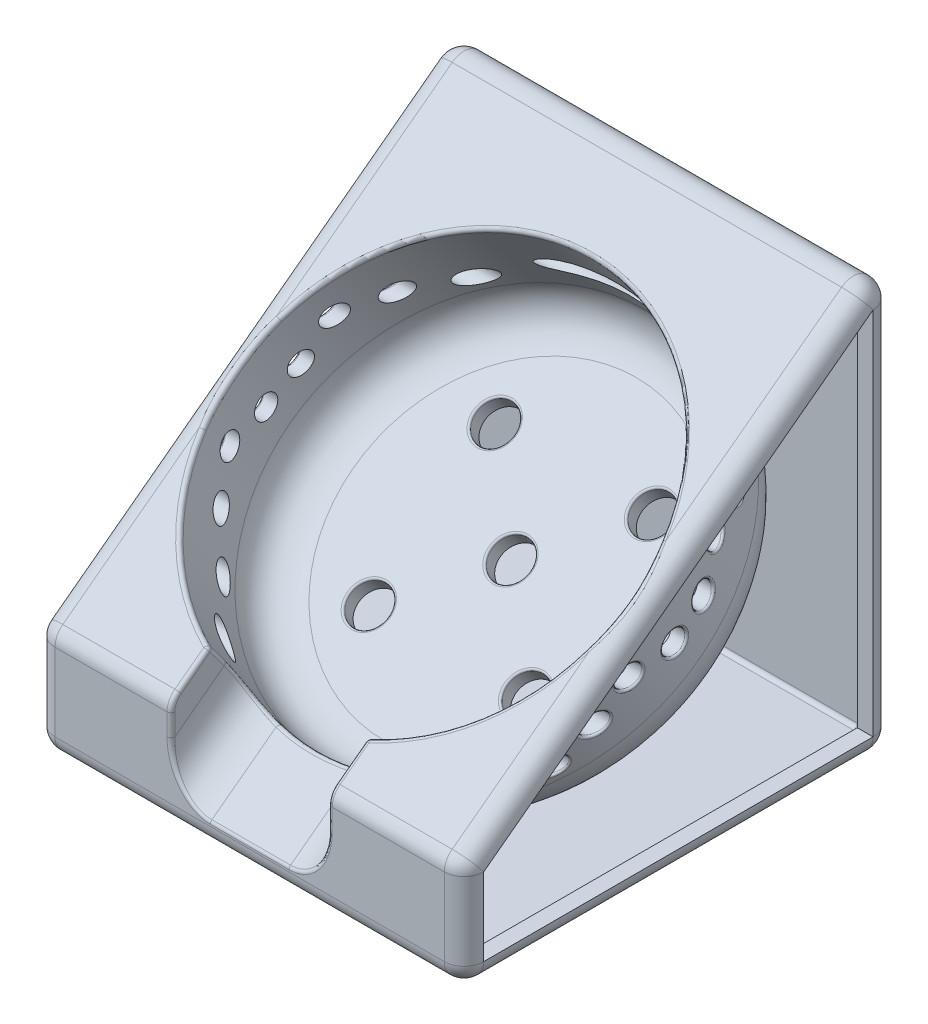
SolidWorks part; units mm, degrees
ref_plane "Front Plane" through (0, 0, 0) normal (0, 0, 1) x (1, 0, 0)
ref_plane "Top Plane" through (0, 0, 0) normal (0, 1, 0) x (1, 0, 0)
ref_plane "Right Plane" through (0, 0, 0) normal (1, 0, 0) x (0, 0, -1)
sketch "Sketch1" plane through (0, 0, 0) normal (0, 1, 0) x (1, 0, 0)
  line L1 (-54.5, -54.5) -> (54.5, -54.5)
  line L2 (-54.5, -54.5) -> (-54.5, 54.5)
  line L3 (-54.5, 54.5) -> (54.5, 54.5)
  line L4 (54.5, -54.5) -> (54.5, 54.5)
  line L5 (-54.5, -54.5) -> (54.5, 54.5) construction
  line L6 (-54.5, 54.5) -> (54.5, -54.5) construction
  point P0 (0, 0)
  dimension "D1" = 109
  dimension "D2" = 109
extrude "Boss-Extrude1" add sketch "Sketch1" along normal blind 109
sketch "Sketch2" plane through (54.5, 0, 0) normal (1, 0, 0) x (0, 0, -1)
  line L0 (-54.5, 0) -> (-54.5, 27.25)
  line L1 (-54.5, 109) -> (-54.5, 0) construction
  line L2 (-54.5, 27.25) -> (54.5, 109)
extrude "Cut-Extrude1" cut sketch "Sketch2" against normal blind 109 and the other way through all
sketch "Sketch3" plane through (0, 43.6, 32.7) normal (0, 0.8, 0.6) x (1, 0, 0)
  line L0 (-54.5, 109) -> (54.5, -27.25) construction
  line L1 (54.5, 109) -> (-54.5, -27.25) construction
  line L2 (0, 40.875) -> (0, 30.875) construction
  circle A1 centre (0, 30.875) radius 50
  dimension "D1" = 100
extrude "Cut-Extrude2" cut sketch "Sketch3" against normal blind 33
fillet "Fillet1" radius 10 1 edges at (0, 5.725, 28.2)
fillet "Fillet3" radius 5 12 edges at (0, 109, -54.5) (-54.5, 54.5, -54.5) (0, 0, -54.5) (54.5, 54.5, -54.5) (54.5, 0, 0) (54.5, 13.625, 54.5) (54.5, 68.125, 0) (-54.5, 0, 0) (0, 0, 54.5) (-54.5, 13.625, 54.5) (0, 27.25, 54.5) (-54.5, 68.125, 0)
fillet "Fillet4" radius 1 4 edges at (49.9106, 63.905, 5.5986) (0, 32.125, 48) (0, 92.125, -32) (-49.9106, 60.318, 10.3812)
sketch "Sketch5" plane through (0, 43.6, 32.7) normal (0, 0.8, 0.6) x (1, 0, 0)
  line L0 (0, 0) -> (0, -24.75) construction
  line L1 (-49.5, -24.75) -> (49.5, -24.75) construction
  line L3 (20, -39.75) -> (-20, -39.75)
  line L4 (20, -39.75) -> (20, -9.75)
  line L5 (20, -9.75) -> (-20, -9.75)
  line L6 (-20, -39.75) -> (-20, -9.75)
  line L7 (20, -39.75) -> (-20, -9.75) construction
  line L8 (20, -9.75) -> (-20, -39.75) construction
  dimension "D1" = 40
  dimension "D2" = 30
extrude "Cut-Extrude3" cut sketch "Sketch5" against normal blind 17
fillet "Fillet7" radius 10 2 edges at (20, 13.5898, 44.3803) (-20, 13.5898, 44.3803)
shell "Shell5" thickness 4
sketch "Sketch7" plane through (0, 4, 0) normal (0, 1, 0) x (1, 0, 0)
  line L0 (0, 0) -> (0, -25) construction
  line L2 (-5, -30) -> (5, -30)
  line L3 (-5, -30) -> (-5, -20)
  line L4 (-5, -20) -> (5, -20)
  line L5 (5, -30) -> (5, -20)
  line L6 (-5, -30) -> (5, -20) construction
  line L7 (-5, -20) -> (5, -30) construction
  dimension "D1" = 10
  dimension "D2" = 10
extrude "Boss-Extrude2" add sketch "Sketch7" along normal blind 5
fillet "Fillet8" radius 5 4 edges at (-5, 5.227, 30) (5, 5.6177, 20) (-5, 5.6177, 20) (5, 5.227, 30)
fillet "Fillet10" radius 1 15 edges at (17.9248, 10.8762, 54.5) (20, 21.625, 54.5) (20, 26.9861, 53.9721) (20, 31.3631, 49.0159) (20, 34.2076, 44.8969) (20, 31.4295, 42.2606) (16.3398, 21.9853, 36.9637) (0, 18.525, 37.8) (-18.0688, 23.8266, 37.5525) (-20, 31.4295, 42.2606) (-20, 34.2018, 44.7233) (-20, 31.3631, 49.0159) (-20, 26.9861, 53.9721) (-20, 21.625, 54.5) (-17.9248, 10.8762, 54.5)
sketch "Sketch8" plane through (0, 0, 0) normal (1, 0, 0) x (0, 0, -1)
  line L0 (34.0313, 71.1485) -> (37.0313, 67.1485) construction
  line L1 (-32.3687, 26.3485) -> (-26.9687, 19.1485) construction
  line L2 (-37.4, 11.325) -> (49, 76.125) construction
  line L3 (39.632, 80.3477) -> (45.0313, 73.1485) construction
  line L4 (39.632, 80.3477) -> (34.0313, 71.1485) construction
  line L5 (34.0313, 71.1485) -> (23.6318, 68.3479) construction
  line L6 (23.6318, 68.3479) -> (13.2313, 65.5485) construction
  line L7 (13.2313, 65.5485) -> (7.6317, 56.3481) construction
  line L8 (7.6317, 56.3481) -> (-0.3684, 50.3481) construction
  line L9 (-0.3684, 50.3481) -> (-10.7687, 47.5485) construction
  line L10 (-10.7687, 47.5485) -> (-16.3685, 38.3483) construction
  line L11 (-16.3685, 38.3483) -> (-21.9687, 29.1485) construction
  line L12 (-21.9687, 29.1485) -> (-32.3687, 26.3485) construction
  line L13 (23.6318, 68.3479) -> (29.0313, 61.1485) construction
  line L14 (13.2313, 65.5485) -> (21.0313, 55.1485) construction
  line L15 (7.6317, 56.3481) -> (13.0313, 49.1485) construction
  line L16 (-0.3684, 50.3481) -> (5.0313, 43.1485) construction
  line L17 (-10.7687, 47.5485) -> (-2.9687, 37.1485) construction
  line L18 (-16.3685, 38.3483) -> (-10.9687, 31.1485) construction
  line L19 (-21.9687, 29.1485) -> (-18.9687, 25.1485) construction
  circle A1 centre (39.632, 80.3477) radius 3
  circle A2 centre (-32.3687, 26.3485) radius 3
  circle A3 centre (34.0313, 71.1485) radius 3
  circle A4 centre (23.6318, 68.3479) radius 3
  circle A5 centre (13.2313, 65.5485) radius 3
  circle A6 centre (7.6317, 56.3481) radius 3
  circle A7 centre (-0.3684, 50.3481) radius 3
  circle A8 centre (-10.7687, 47.5485) radius 3
  circle A9 centre (-16.3685, 38.3483) radius 3
  circle A10 centre (-21.9687, 29.1485) radius 3
  dimension "D1" = 8.999
  dimension "D3" = 90
  dimension "D2" = 9
  dimension "D4" = 8.9992
  dimension "D5" = 5
  dimension "D6" = 8.9994
  dimension "D7" = 13
  dimension "D8" = 8.9995
extrude "Cut-Extrude4" cut sketch "Sketch8" against normal through all and the other way through all
sketch "Sketch10" plane through (0, 17.2, 12.9) normal (0, 0.8, 0.6) x (1, 0, 0)
  line L0 (0, 70.875) -> (0, -9.125) construction
  line L1 (0, -9.125) -> (-40, 30.875) construction
  line L2 (-40, 30.875) -> (0, 70.875) construction
  line L3 (0, 70.875) -> (40, 30.875) construction
  line L4 (40, 30.875) -> (0, -9.125) construction
  circle A0 centre (0, 30.875) radius 40 construction
  circle A1 centre (0, 30.875) radius 28.2843 construction
  circle A2 centre (20, 50.875) radius 5
  circle A3 centre (-20, 50.875) radius 5
  circle A4 centre (-20, 10.875) radius 5
  circle A5 centre (20, 10.875) radius 5
  circle A6 centre (0, 30.875) radius 5
extrude "Cut-Extrude5" cut sketch "Sketch10" against normal up to surface (4 mm away)
fillet "Fillet11" radius 0.5 24 edges at (47.2512, 64.9992, -10.2821) (-51.1823, 66.3598, -10.3431) (51.4682, 64.9782, -10.2861) (-39.2215, 71.8379, -31.1116) (39.711, 71.07, -31.0324) (-46.6549, 69.1287, -20.7352) (47.0554, 68.086, -20.6433) (-53.5248, 57.0769, -4.7216) (53.6303, 55.7019, -4.7021) (-53.9227, 51.0296, 3.2899) (53.8725, 49.6621, 3.2889) (-52.4354, 48.2102, 13.6948) (52.2301, 46.8553, 13.6875) (-48.9053, 39.0198, 19.2924) (48.5195, 37.6748, 19.2919) (-42.5135, 29.2546, 24.9668) (42.3182, 28.8199, 24.9506) (-32.0706, 26.2033, 35.3651) (31.8994, 25.9656, 35.3441) (20, 20.725, 8.2) (-20, 20.725, 8.2) (0, 32.725, -7.8) (20, 44.725, -23.8) (-20, 44.725, -23.8)
fillet "Fillet12" radius 0.5 2 edges at (26.9329, 80.6074, -36.6432) (-23.7822, 82.3709, -37.4168)
fillet "Fillet13" radius 1 8 edges at (3.0914, 6.0659, 28.9298) (-3.968, 5.9589, 28.0422) (-2.9545, 6.7681, 20.9663) (-3.5355, 4, 21.4645) (-3.5355, 4, 28.5355) (3.5355, 4, 28.5355) (3.9555, 6.4495, 21.9416) (3.5355, 4, 21.4645)
fillet "Fillet14" radius 1 16 edges at (24, 27.7254, 47.1994) (24, 25.1972, 50.3944) (24, 23.125, 50.5) (-24, 27.7254, 47.1994) (-24, 25.1972, 50.3944) (-24, 23.125, 50.5) (-21.4304, 11.3953, 50.5) (-24, 28.7009, 43.3988) (-21.3707, 20.2363, 38.5725) (0, 12.925, 38.6) (24, 28.7009, 43.3988) (21.4304, 11.3953, 50.5) (18.7986, 17.4399, 37.764) (12.8267, 4.473, 50.3499) (-12.8267, 4.473, 50.3499) (0, 4.2521, 50.1638)
